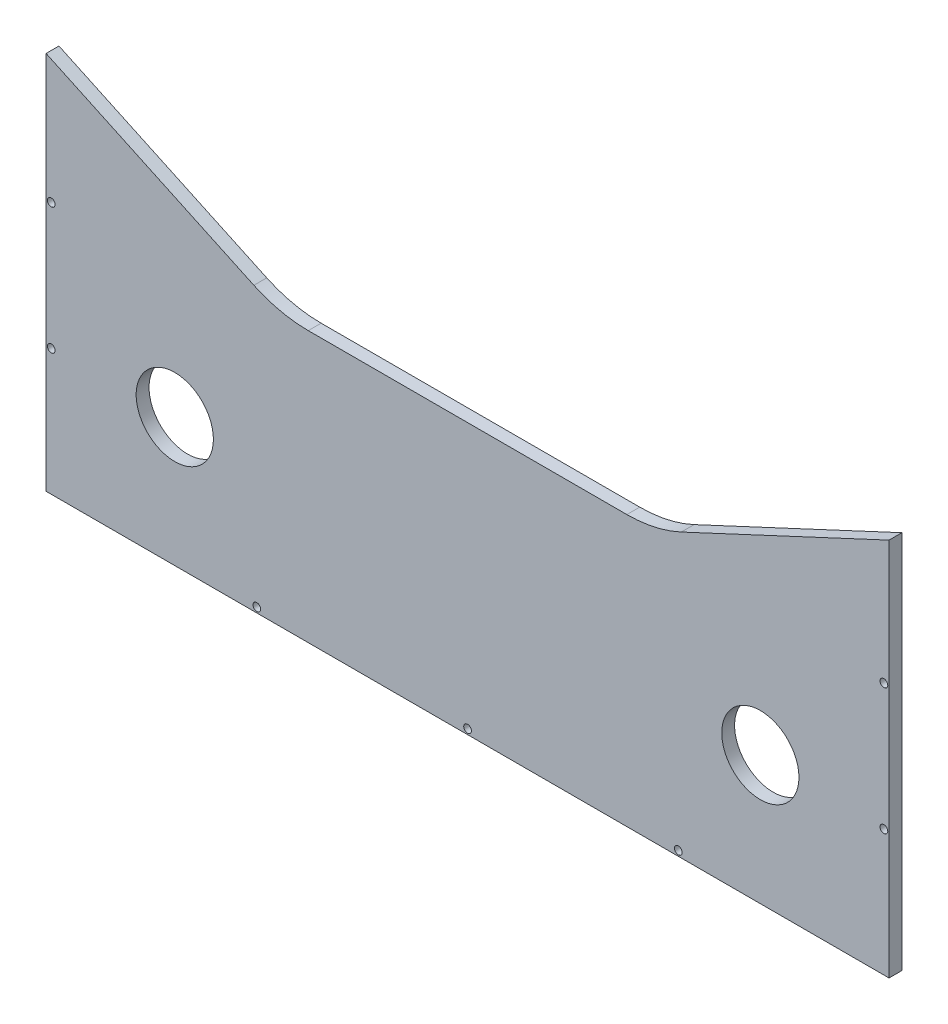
SolidWorks part; units mm, degrees
ref_plane "Front" through (0, 0, 0) normal (0, 0, 1) x (1, 0, 0)
ref_plane "Top" through (0, 0, 0) normal (0, 1, 0) x (1, 0, 0)
ref_plane "Right" through (0, 0, 0) normal (1, 0, 0) x (0, 0, -1)
sketch "Sketch1" plane through (0, 0, 0) normal (0, 0, 1) x (1, 0, 0)
  line L0 (72.973, 52.5) -> (163.75, 94.83)
  line L1 (-163.75, 52.5) -> (163.75, 52.5)
  line L2 (-163.75, 52.5) -> (-163.75, -52.5)
  line L3 (-163.75, -52.5) -> (163.75, -52.5)
  line L4 (163.75, 52.5) -> (163.75, -52.5)
  line L5 (-163.75, 52.5) -> (163.75, -52.5) construction
  line L6 (-163.75, -52.5) -> (163.75, 52.5) construction
  line L7 (-72.973, 52.5) -> (-163.75, 94.83)
  line L8 (-163.75, 94.83) -> (-163.75, 52.5)
  line L9 (163.75, 94.83) -> (163.75, 52.5)
  point P0 (0, 0)
  dimension "D1" = 25
  dimension "D2" = 25
  dimension "D3" = 105
  dimension "D4" = 327.5
  dimension "D5" = 42.33
  dimension "D6" = 42.33
extrude "Boss-Extrude1" add sketch "Sketch1" along normal blind 5 contours L4 L1 L2 L3 | L7 L8 L1 | L9 L0 L1
fillet "Fillet1" radius 50 2 edges at (72.973, 52.5, 2.5) (-72.973, 52.5, 2.5)
sketch "Sketch2" plane through (0, 0, 5) normal (0, 0, 1) x (1, 0, 0)
  line L0 (-163.75, -52.5) -> (163.75, -52.5) construction
  line L1 (-163.75, 94.83) -> (-163.75, -52.5) construction
  line L2 (163.75, 94.83) -> (163.75, -52.5) construction
  circle A0 centre (-113.75, -2.5) radius 15
  circle A1 centre (113.75, -2.5) radius 15
  dimension "D1" = 30
  dimension "D2" = 50
  dimension "D3" = 50
  dimension "D4" = 50
  dimension "D5" = 50
extrude "Cut-Extrude1" cut sketch "Sketch2" against normal through all
sketch "Sketch4" plane through (0, 0, 5) normal (0, 0, 1) x (1, 0, 0)
  line L0 (-163.75, -52.5) -> (163.75, -52.5) construction
  line L1 (-163.75, 94.83) -> (-163.75, -52.5) construction
  line L2 (0, -52.5) -> (0, -14.7753)
  circle A0 centre (-81.875, -50.5) radius 1.5
  circle A1 centre (0, -50.5) radius 1.5
  circle A2 centre (81.875, -50.5) radius 1.5
  circle A3 centre (-161.75, 45.72) radius 1.5
  circle A4 centre (-161.75, -3.39) radius 1.5
  circle A5 centre (161.75, -3.39) radius 1.5
  circle A6 centre (161.75, 45.72) radius 1.5
  point P0 (-81.875, -50.5)
  point P1 (0, -50.5)
  point P2 (81.875, -50.5)
  point P11 (-161.75, 45.72)
  point P12 (-161.75, -3.39)
  dimension "D2" = 2
  dimension "D5" = 3
  dimension "D6" = 81.875
  dimension "D1" = 2
  dimension "D3" = 49.11
  dimension "D4" = 49.11
  dimension "D7" = 81.875
  dimension "D8" = 81.875
extrude "Cut-Extrude3" cut sketch "Sketch4" against normal blind 10 contours A3 | A4 | A0 | L2 A1 | L2 A1 | A2 | A5 | A6
sketch "Sketch5" plane through (0, 0, 5) normal (0, 0, 1) x (1, 0, 0)
  line L0 (-163.75, 94.83) -> (-85.0284, 58.1215)
  line L2 (-163.75, 94.83) -> (-163.75, -52.5)
  line L3 (-163.75, -52.5) -> (163.75, -52.5)
  line L4 (163.75, 94.83) -> (163.75, -52.5)
  line L5 (163.75, 94.83) -> (85.0284, 58.1215)
  line L6 (83.0192, 57.1846) -> (163.75, 94.83) construction
  line L7 (-59.6713, 52.5) -> (59.6713, 52.5)
  line L8 (-61.8883, 52.5) -> (61.8883, 52.5) construction
  line L9 (-83.0192, 57.1846) -> (-163.75, 94.83) construction
  arc A0 (-59.6713, 52.5) -> (-85.0284, 58.1215) centre (-59.6713, 112.5) cw
  arc A1 (59.6713, 52.5) -> (85.0284, 58.1215) centre (59.6713, 112.5) ccw
  circle A2 centre (113.75, -2.5) radius 15
  circle A3 centre (-113.75, -2.5) radius 15
  circle A4 centre (-161.75, 45.72) radius 1.5075
  circle A5 centre (-161.75, -3.39) radius 1.5
  circle A6 centre (-81.875, -50.5) radius 1.5
  circle A7 centre (0, -50.5) radius 1.5
  circle A8 centre (81.875, -50.5) radius 1.5
  circle A9 centre (161.75, -3.39) radius 1.5
  circle A10 centre (161.75, 45.72) radius 1.5
  point P20 (-72.973, 52.5)
  point P23 (72.973, 52.5)
  dimension "D1" = 60
